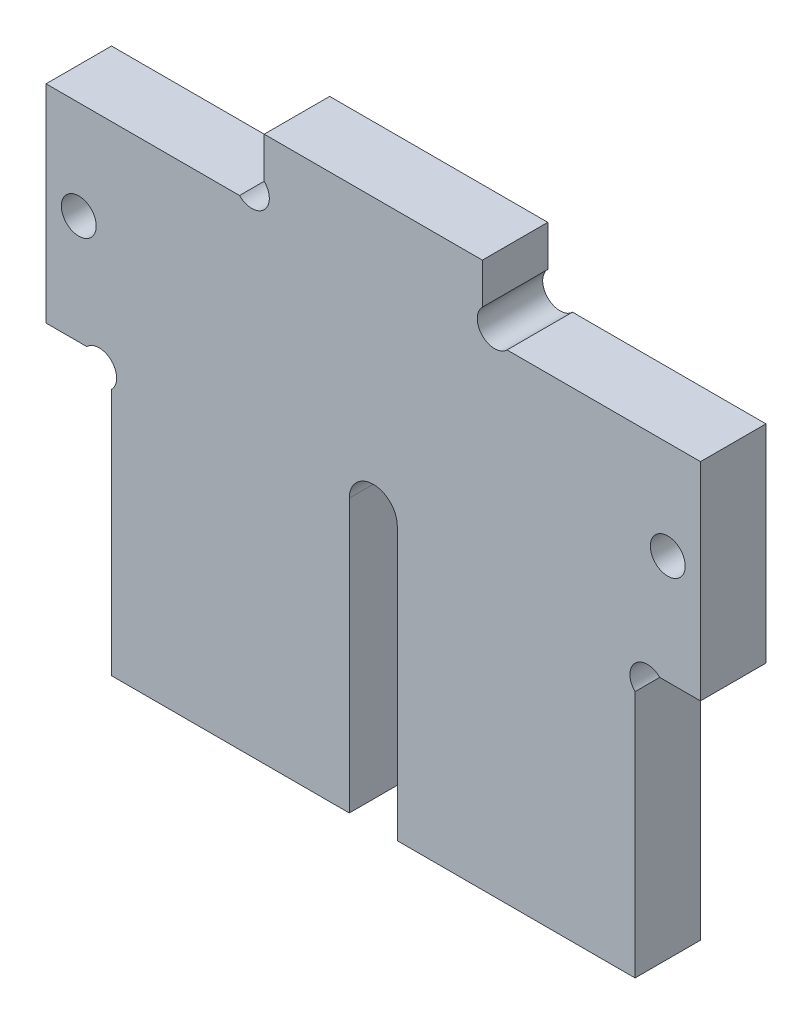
SolidWorks part; units mm, degrees
ref_plane "Plan de face" through (0, 0, 0) normal (0, 0, 1) x (1, 0, 0)
ref_plane "Plan de dessus" through (0, 0, 0) normal (0, 1, 0) x (1, 0, 0)
ref_plane "Plan de droite" through (0, 0, 0) normal (1, 0, 0) x (0, 0, -1)
sketch "Esquisse1" plane through (0, 0, 0) normal (0, 0, 1) x (1, 0, 0)
  line L0 (0, -5.3425) -> (0, 69.7724) construction
  line L1 (-53.7752, 0) -> (69.3659, 0) construction
  line L2 (-53.7752, 50) -> (69.3659, 50) construction
  line L3 (30, -5.3425) -> (30, 77.9943) construction
  line L4 (-30, -5.3425) -> (-30, 79.3023) construction
  line L5 (59.6492, 44) -> (-10.6104, 44) construction
  line L6 (10, 62.1112) -> (10, 42.1171) construction
  line L7 (24, 62.1112) -> (24, -5.3425) construction
  line L8 (59.6492, 25) -> (-6.3004, 25) construction
  line L9 (27, 39.1273) -> (27, 33.0146) construction
  line L10 (59.6492, 35) -> (41.15, 35) construction
  line L11 (10, 44) -> (22.0233, 56.0233) construction
  line L12 (24, 25) -> (33.2711, 15.7289) construction
  line L13 (10, 46.2627) -> (10, 50)
  line L14 (12.2627, 44) -> (30, 44)
  line L15 (30, 44) -> (30, 25)
  line L16 (30, 25) -> (26.2627, 25)
  line L17 (24, 22.7373) -> (24, 0)
  line L18 (-24, 22.7373) -> (-24, 0)
  line L19 (-30, 25) -> (-26.2627, 25)
  line L20 (-30, 44) -> (-30, 25)
  line L21 (-12.2627, 44) -> (-30, 44)
  line L22 (-10, 46.2627) -> (-10, 50)
  line L23 (-10, 50) -> (10, 50)
  line L24 (-24, 0) -> (-2.2, 0)
  line L25 (-2.2, 25) -> (-2.2, 0)
  line L26 (2.2, 25) -> (2.2, 0)
  line L27 (2.2, 0) -> (24, 0)
  circle A0 centre (27, 35) radius 1.6
  arc A1 (10, 46.2627) -> (12.2627, 44) centre (11.1314, 45.1314) ccw
  arc A2 (26.2627, 25) -> (24, 22.7373) centre (25.1314, 23.8686) ccw
  arc A3 (-26.2627, 25) -> (-24, 22.7373) centre (-25.1314, 23.8686) cw
  arc A4 (-10, 46.2627) -> (-12.2627, 44) centre (-11.1314, 45.1314) cw
  circle A5 centre (-27, 35) radius 1.6
  arc A6 (2.2, 25) -> (-2.2, 25) centre (0, 25) ccw
  dimension "D1" = 50
  dimension "D2" = 60
  dimension "D3" = 30
  dimension "D4" = 6
  dimension "D5" = 25
  dimension "D6" = 6
  dimension "D7" = 10
  dimension "D8" = 10
  dimension "D9" = 3
  dimension "D10" = 45
  dimension "D11" = 45
extrude "Boss.-Extru.1" add sketch "Esquisse1" along normal blind 6
